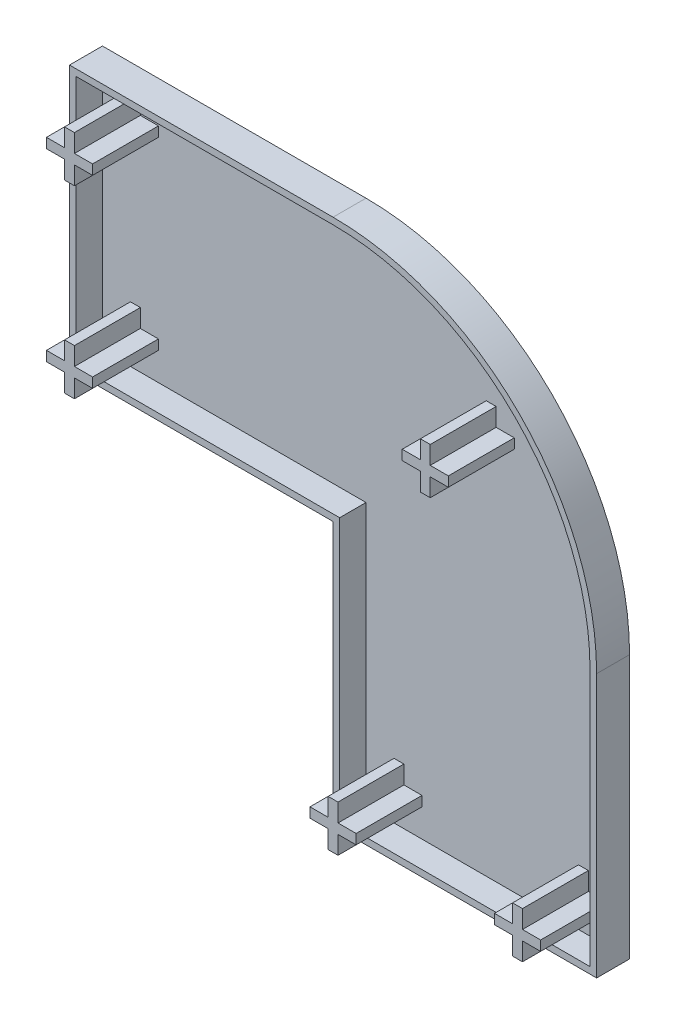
SolidWorks part; units mm, degrees
ref_plane "前视基准面" through (0, 0, 0) normal (0, 0, 1) x (1, 0, 0)
ref_plane "上视基准面" through (0, 0, 0) normal (0, 1, 0) x (1, 0, 0)
ref_plane "右视基准面" through (0, 0, 0) normal (1, 0, 0) x (0, 0, -1)
sketch "草图1" plane through (0, 0, 0) normal (0, 0, 1) x (1, 0, 0)
  line L1 (-40, 40) -> (0, 40)
  line L2 (-40, 40) -> (-40, 0)
  line L3 (0, -40) -> (40, -40)
  line L4 (40, 0) -> (40, -40)
  line L7 (-40, 0) -> (0, 0)
  line L8 (0, -40) -> (0, 0)
  arc A1 (40, 0) -> (0, 40) centre (0, 0) ccw
  dimension "D3" = 40
  dimension "D4" = 40
extrude "凸台-拉伸1" add sketch "草图1" along normal mid plane 5
shell "抽壳1" thickness 1
sketch "草图2" plane through (0, 0, -1.5) normal (0, 0, 1) x (1, 0, 0)
  line L0 (20.75, 19.25) -> (23.5, 19.25)
  line L1 (16.5, 20.75) -> (19.25, 20.75)
  line L2 (16.5, 20.75) -> (16.5, 19.25)
  line L3 (16.5, 19.25) -> (19.25, 19.25)
  line L4 (23.5, 20.75) -> (23.5, 19.25)
  line L5 (19.25, 23.5) -> (20.75, 23.5)
  line L6 (19.25, 23.5) -> (19.25, 20.75)
  line L7 (19.25, 16.5) -> (20.75, 16.5)
  line L8 (20.75, 23.5) -> (20.75, 20.75)
  line L9 (20.75, 20.75) -> (23.5, 20.75)
  line L10 (20.75, 19.25) -> (20.75, 16.5)
  line L11 (19.25, 19.25) -> (19.25, 16.5)
  line L13 (20, 23.5) -> (20, 12.337) construction
  line L15 (-40, 40) -> (-40, 0) construction
  line L16 (16.5, 20) -> (23.5, 20) construction
  line L17 (0, 40) -> (-40, 40) construction
  line L26 (6.75, -34.75) -> (9.5, -34.75)
  line L27 (2.5, -33.25) -> (5.25, -33.25)
  line L28 (2.5, -33.25) -> (2.5, -34.75)
  line L29 (5.25, -30.5) -> (6.75, -30.5)
  line L30 (6.75, -30.5) -> (6.75, -33.25)
  line L31 (6.75, -33.25) -> (9.5, -33.25)
  line L32 (6.75, -34.75) -> (6.75, -37.5)
  line L33 (5.25, -30.5) -> (5.25, -33.25)
  line L34 (5.25, -37.5) -> (6.75, -37.5)
  line L35 (2.5, -34.75) -> (5.25, -34.75)
  line L36 (9.5, -33.25) -> (9.5, -34.75)
  line L37 (5.25, -34.75) -> (5.25, -37.5)
  line L38 (2.5, -34) -> (9.5, -34) construction
  line L39 (34.75, -34.75) -> (37.5, -34.75)
  line L40 (30.5, -33.25) -> (33.25, -33.25)
  line L41 (30.5, -33.25) -> (30.5, -34.75)
  line L42 (33.25, -30.5) -> (34.75, -30.5)
  line L43 (34.75, -30.5) -> (34.75, -33.25)
  line L44 (34.75, -33.25) -> (37.5, -33.25)
  line L45 (34.75, -34.75) -> (34.75, -37.5)
  line L46 (33.25, -30.5) -> (33.25, -33.25)
  line L47 (33.25, -37.5) -> (34.75, -37.5)
  line L48 (30.5, -34.75) -> (33.25, -34.75)
  line L49 (37.5, -33.25) -> (37.5, -34.75)
  line L50 (33.25, -34.75) -> (33.25, -37.5)
  line L51 (30.5, -34) -> (37.5, -34) construction
  line L52 (0, 0) -> (28.2843, 28.2843) construction
  line L53 (-34, 30.5) -> (-34, 37.5) construction
  line L54 (-34, 2.5) -> (-34, 9.5) construction
  line L55 (-34.75, 33.25) -> (-37.5, 33.25)
  line L56 (-33.25, 37.5) -> (-34.75, 37.5)
  line L57 (-34.75, 30.5) -> (-34.75, 33.25)
  line L58 (-37.5, 33.25) -> (-37.5, 34.75)
  line L59 (-30.5, 33.25) -> (-33.25, 33.25)
  line L60 (-34.75, 34.75) -> (-37.5, 34.75)
  line L61 (-33.25, 34.75) -> (-33.25, 37.5)
  line L62 (-30.5, 34.75) -> (-33.25, 34.75)
  line L63 (-30.5, 33.25) -> (-30.5, 34.75)
  line L64 (-33.25, 30.5) -> (-34.75, 30.5)
  line L65 (-33.25, 30.5) -> (-33.25, 33.25)
  line L66 (-34.75, 34.75) -> (-34.75, 37.5)
  line L67 (-34.75, 5.25) -> (-37.5, 5.25)
  line L68 (-33.25, 9.5) -> (-34.75, 9.5)
  line L69 (-34.75, 2.5) -> (-34.75, 5.25)
  line L70 (-37.5, 5.25) -> (-37.5, 6.75)
  line L71 (-30.5, 5.25) -> (-33.25, 5.25)
  line L72 (-34.75, 6.75) -> (-37.5, 6.75)
  line L73 (-33.25, 6.75) -> (-33.25, 9.5)
  line L74 (-30.5, 6.75) -> (-33.25, 6.75)
  line L75 (-30.5, 5.25) -> (-30.5, 6.75)
  line L76 (-33.25, 2.5) -> (-34.75, 2.5)
  line L77 (-33.25, 2.5) -> (-33.25, 5.25)
  line L78 (-34.75, 6.75) -> (-34.75, 9.5)
  arc A0 (40, 0) -> (0, 40) centre (0, 0) ccw construction
  dimension "D1" = 1.5
  dimension "D2" = 1.5
  dimension "D3" = 7
  dimension "D4" = 7
  dimension "D5" = 2.75
  dimension "D6" = 2.75
  dimension "D7" = 60
  dimension "D8" = 20
extrude "凸台-拉伸2" add sketch "草图2" along normal blind 10
